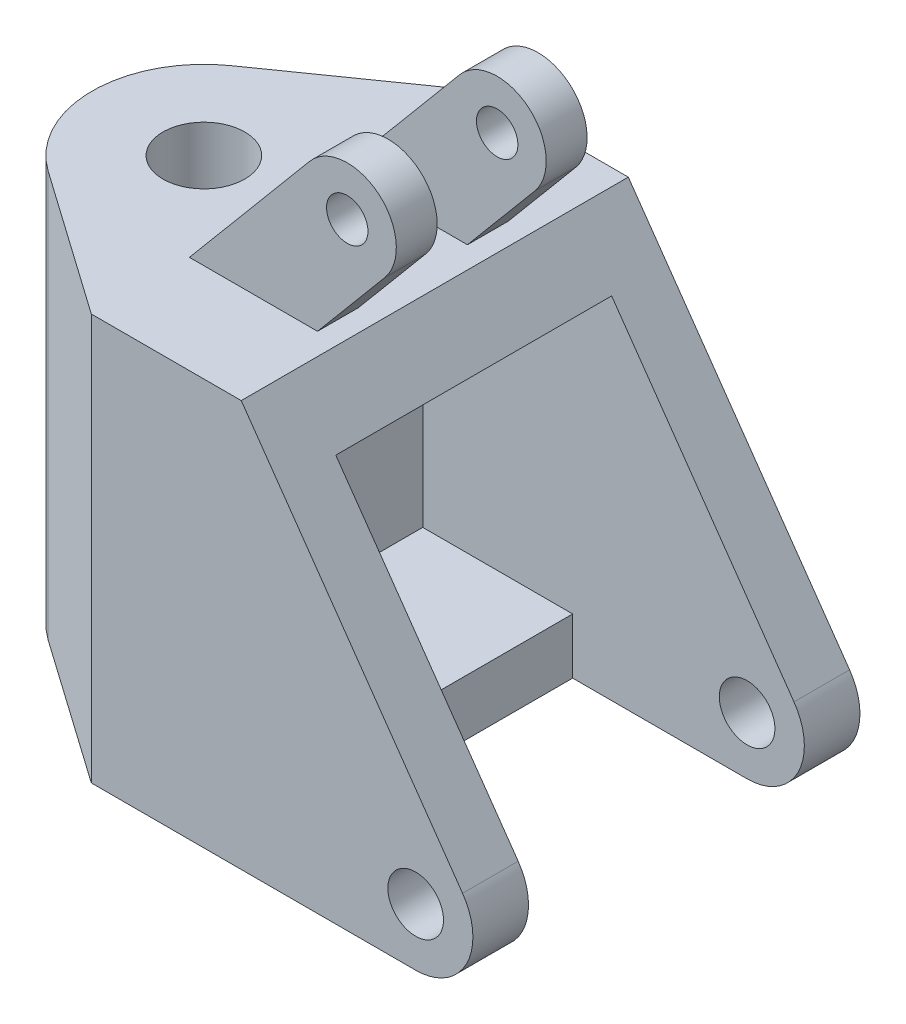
SolidWorks part; units mm, degrees
ref_plane "Front Plane" through (0, 0, 0) normal (0, 0, 1) x (1, 0, 0)
ref_plane "Top Plane" through (0, 0, 0) normal (0, 1, 0) x (1, 0, 0)
ref_plane "Right Plane" through (0, 0, 0) normal (1, 0, 0) x (0, 0, -1)
sketch "Sketch1" plane through (0, 0, 0) normal (0, 0, 1) x (1, 0, 0)
  line L0 (0, -105) -> (-595, -105)
  line L1 (-595, -105) -> (-595, 640)
  line L2 (-595, 640) -> (-319.9515, 640)
  line L3 (-319.9515, 640) -> (86.011, 60.2255)
  circle A2 centre (0, 0) radius 105
  circle A3 centre (0, 0) radius 51
  dimension "D1" = 210
  dimension "D2" = 102
  dimension "D3" = 595
  dimension "D4" = 55
  dimension "D5" = 745
extrude "Boss-Extrude1" add sketch "Sketch1" along normal mid plane 710 contours A2 L3 L2 L1 L0 | A2 A3
sketch "Sketch2" plane through (-595, 0, 0) normal (-1, 0, 0) x (0, 0, 1)
  line L1 (-253, 538) -> (253, 538)
  line L2 (-253, 538) -> (-253, -3)
  line L3 (-253, -3) -> (253, -3)
  line L4 (253, 538) -> (253, -3)
  line L5 (355, -105) -> (355, 640) construction
  point P4 (0, -3)
  point P5 (253, 267.5)
  point P9 (355, 267.5)
  dimension "D1" = 506
  dimension "D2" = 541
extrude "Cut-Extrude1" cut sketch "Sketch2" against normal through all
sketch "Sketch3" plane through (0, -105, 0) normal (0, -1, 0) x (1, 0, 0)
  line L5 (86.011, -253) -> (-248.5303, -253) construction
  line L6 (105, 253) -> (-320, 253)
  line L7 (105, 253) -> (105, -253)
  line L8 (105, -253) -> (-320, -253)
  line L9 (-320, 253) -> (-320, -253)
  dimension "D1" = 425
extrude "Cut-Extrude2" cut sketch "Sketch3" against normal up to next
sketch "Sketch4" plane through (0, 0, 0) normal (0, 0, 1) x (1, 0, 0)
  line L0 (-595, 640) -> (-374.4419, 902.8509)
  line L1 (-595, 640) -> (-319.9515, 640) construction
  line L2 (-236.5539, 787.1491) -> (-360.0267, 640)
  line L3 (-360.0267, 640) -> (-595, 640)
  circle A0 centre (-305.4979, 845) radius 90
  circle A1 centre (-305.4979, 845) radius 38
  dimension "D2" = 180
  dimension "D4" = 76
  dimension "D1" = 205
  dimension "D3" = 50
extrude "Boss-Extrude3" add sketch "Sketch4" along normal blind 75 from offset 100 contours A0 A1 | A0 L0 L3 L2
mirror "Mirror1" about plane through (0, 0, 0) normal (0, 0, 1) of "Boss-Extrude3"
sketch "Sketch5" plane through (0, 640, 0) normal (0, 1, 0) x (1, 0, 0)
  line L0 (-595, 355) -> (-861.4257, 167.7071)
  line L1 (-861.4257, -167.7071) -> (-595, -355)
  line L2 (-248.5303, 253) -> (-248.5303, -253) construction
  line L3 (-595, 355) -> (-595, -355)
  arc A0 (-861.4257, 167.7071) -> (-861.4257, -167.7071) centre (-743.5303, 0) ccw
  circle A1 centre (-743.5303, 0) radius 75
  dimension "D1" = 495
  dimension "D2" = 205
  dimension "D3" = 150
extrude "Boss-Extrude4" add sketch "Sketch5" against normal up to surface (643 mm away)
ref_plane "Plane1" through (0, 267.5, 0) normal (0, 1, 0) x (1, 0, 0)
mirror "Mirror2" about plane through (0, 267.5, 0) normal (0, 1, 0) of "Boss-Extrude4"
